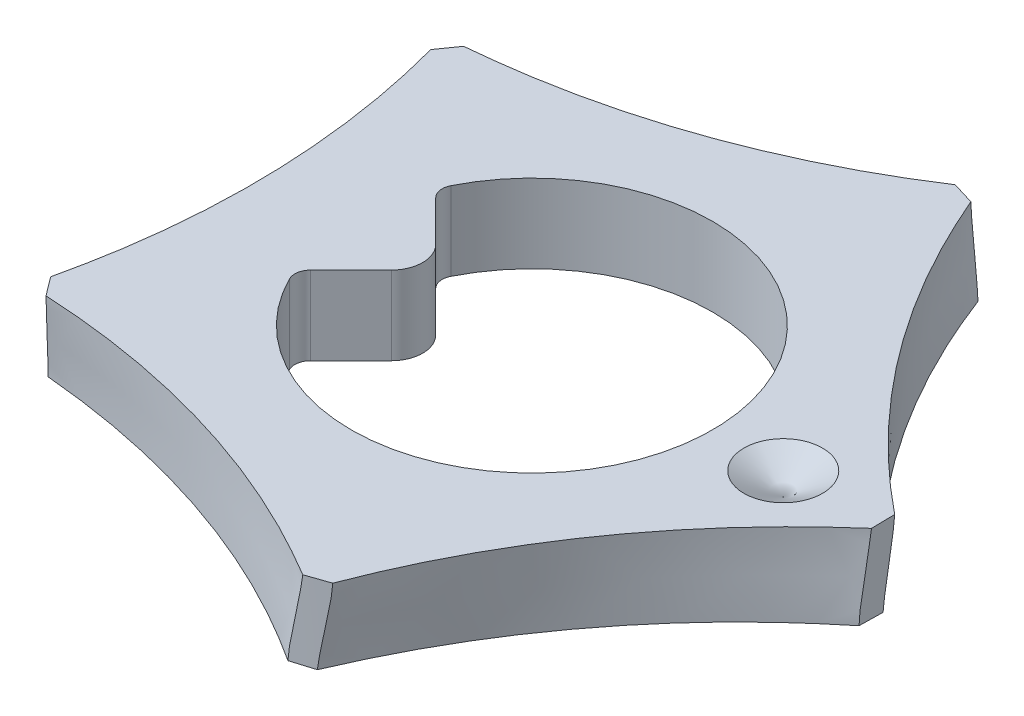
SolidWorks part; units mm, degrees
ref_plane "Front Plane" through (0, 0, 0) normal (0, 0, 1) x (1, 0, 0)
ref_plane "Top Plane" through (0, 0, 0) normal (0, 1, 0) x (1, 0, 0)
ref_plane "Right Plane" through (0, 0, 0) normal (1, 0, 0) x (0, 0, -1)
sketch "Sketch2" plane through (0, 0, 0) normal (0, 1, 0) x (1, 0, 0)
  circle A0 centre (0, 0) radius 2.2
  dimension "D1" = 4.4
extrude "Boss-Extrude2" add sketch "Sketch2" along normal blind 0.5 contours A0
sketch "Sketch3" plane through (0, 0.5, 0) normal (0, 1, 0) x (1, 0, 0)
  line L0 (0, 0) -> (2.2, 0) construction
  line L1 (0, 0) -> (0.6798, -2.0923) construction
  line L2 (0, 0) -> (-0.6798, -2.0923) construction
  line L3 (0, 0) -> (0, -2.2) construction
  circle A0 centre (0, 0) radius 2.2 construction
  arc A1 (0.7508, 2.0679) -> (2.1987, 0.075) centre (5.3952, 3.9198) ccw
  arc A2 (2.1987, -0.075) -> (0.7508, -2.0679) centre (5.3952, -3.9198) ccw
  arc A3 (0.6081, -2.1143) -> (-1.7347, -1.353) centre (-2.0608, -6.3424) ccw
  arc A4 (-1.7347, 1.353) -> (-1.8229, 1.2317) centre (0, 0) ccw
  arc A5 (-1.8229, -1.2317) -> (-1.8229, 1.2317) centre (-6.6688, 0) ccw
  arc A6 (-1.7347, 1.353) -> (0.6081, 2.1143) centre (-2.0608, 6.3424) ccw
  arc A7 (-1.8229, -1.2317) -> (-1.7347, -1.353) centre (0, 0) ccw
  arc A8 (0.7508, 2.0679) -> (0.6081, 2.1143) centre (0, 0) ccw
  arc A9 (2.1987, -0.075) -> (2.1987, 0.075) centre (0, 0) ccw
  arc A10 (0.6081, -2.1143) -> (0.7508, -2.0679) centre (0, 0) ccw
  point P25 (0, 0)
  dimension "D3" = 5
  dimension "D4" = 5
  dimension "D1" = 72
  dimension "D2" = 72
  dimension "D5" = 0.15
extrude "Cut-Extrude1" cut sketch "Sketch3" against normal blind 0.5 flip side to cut
other "Flex4" parameters "D0"=2, "D1"=0, "D2"=0
sketch "Sketch4" plane through (0, 0.5, 0) normal (0, 1, 0) x (1, 0, 0)
  line L0 (0, 0) -> (-1.15, 0) construction
  line L1 (-1.0594, 0.4474) -> (-0.612, 0)
  line L2 (-0.612, 0) -> (-1.0594, -0.4474)
  arc A0 (-1.0594, -0.4474) -> (-1.0594, 0.4474) centre (0, 0) ccw
  dimension "D1" = 2.3
  dimension "D2" = 0.612
extrude "Cut-Extrude2" cut sketch "Sketch4" against normal up to next
fillet "Fillet1" radius 0.2 1 edges at (-0.612, 0.25, 0)
fillet "Fillet2" radius 0.1 2 edges at (-1.0594, 0.25, 0.4474) (-1.0594, 0.25, -0.4474)
sketch "Sketch6" plane through (0, 0, 0) normal (0, 0, 1) x (1, 0, 0)
  line L0 (1.6, 0.5) -> (1.6, 0.1807) construction
  line L1 (2.1986, 0.5) -> (0.7863, 0.5) construction
  line L2 (1.6, 0.5) -> (1.6, 0.3557)
  line L3 (1.6, 0.3557) -> (1.85, 0.5)
  line L4 (1.6, 0.5) -> (1.85, 0.5)
  dimension "D1" = 1.6
  dimension "D2" = 60
  dimension "D3" = 0.5
revolve "Cut-Revolve7" cut sketch "Sketch6" angle 360 about L0
